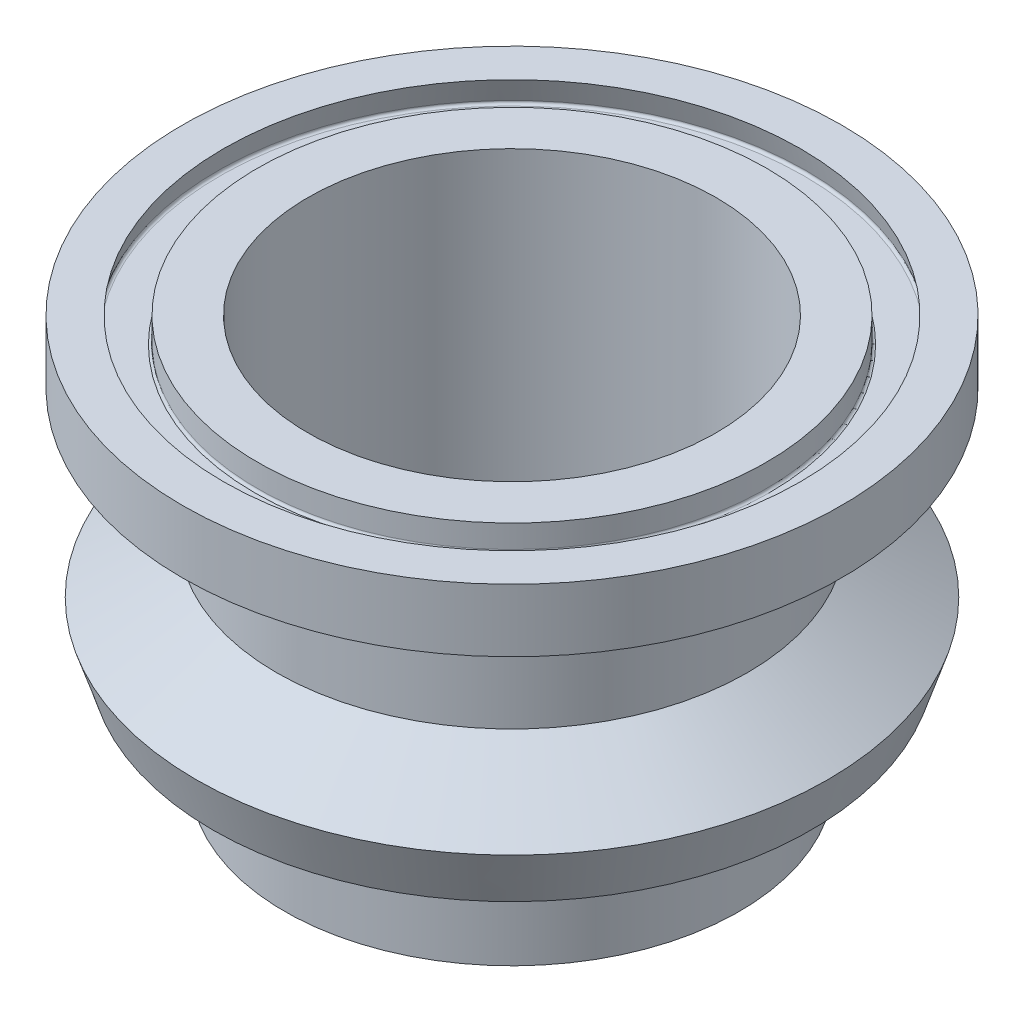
SolidWorks part; units mm, degrees
ref_plane "Front" through (0, 0, 0) normal (0, 0, 1) x (1, 0, 0)
ref_plane "Top" through (0, 0, 0) normal (0, 1, 0) x (1, 0, 0)
ref_plane "Right" through (0, 0, 0) normal (1, 0, 0) x (0, 0, -1)
sketch "Sketch1" plane through (0, 0, 0) normal (0, 0, 1) x (1, 0, 0)
  line L0 (0, 0) -> (0, 127) construction
  line L1 (33.3375, 127) -> (0, 127) construction
  line L2 (33.3375, 127) -> (33.3375, 120.65)
  line L3 (33.3375, 120.65) -> (23.8125, 120.65)
  line L4 (23.8125, 120.65) -> (23.8125, 107.5831)
  line L5 (23.8125, 107.5831) -> (31.9591, 102.2926)
  line L6 (33.3375, 101.3975) -> (31.75, 96.5116) construction
  line L7 (25.586, 98.3614) -> (22.9997, 98.9625)
  line L8 (22.9997, 98.9625) -> (22.9997, 86.2625)
  line L9 (22.9997, 86.2625) -> (20.6375, 86.2625)
  line L10 (29.9048, 99.8601) -> (26.4953, 100.7737)
  line L11 (20.6375, 86.2625) -> (20.6375, 127)
  line L12 (33.3375, 127) -> (29.183, 127)
  line L13 (25.7556, 127) -> (20.6375, 127)
  line L14 (0, 0) -> (26.9683, 100.6469) construction
  line L15 (28.885, 97.4542) -> (30.0591, 99.4877)
  line L16 (26.1842, 100.594) -> (25.586, 98.3614)
  line L17 (30.242, 97.0077) -> (28.885, 97.4542)
  line L18 (0, 101.6) -> (2.8607, 112.2763) construction
  line L19 (29.183, 127) -> (29.7847, 124.7543)
  line L20 (25.7556, 127) -> (25.7556, 124.6886)
  line L21 (29.5394, 124.4346) -> (26.0096, 124.4346)
  line L22 (0, 0) -> (68.5329, 165.453) construction
  line L23 (31.9591, 102.2926) -> (30.242, 97.0077)
  line L24 (31.8277, 101.888) -> (30.2402, 97.0022) construction
  arc A0 (26.4953, 100.7737) -> (26.1842, 100.594) centre (26.4296, 100.5283) ccw
  arc A1 (29.9048, 99.8601) -> (30.0591, 99.4877) centre (29.8391, 99.6147) cw
  circle A2 centre (0, 0) radius 101.6 construction
  circle A3 centre (27.4972, 98.6776) radius 1.7653 construction
  arc A4 (25.7556, 124.6886) -> (26.0096, 124.4346) centre (26.0096, 124.6886) ccw
  arc A5 (29.7847, 124.7543) -> (29.5394, 124.4346) centre (29.5394, 124.6886) cw
  point P26 (30.2246, 99.7744)
  point P31 (25.7556, 124.4346)
  point P34 (29.8704, 124.4346)
  dimension "D4" = 203.2
  dimension "D5" = 0.254
  dimension "D8" = 3.5306
  dimension "D28" = 0.254
  dimension "D1" = 15
  dimension "D3" = 45.9994
  dimension "D6" = 4.1148
  dimension "D7" = 2.5654
  dimension "D9" = 18
  dimension "D10" = 51.1048
  dimension "D11" = 27.4972
  dimension "D12" = 75
  dimension "D13" = 66.675
  dimension "D14" = 3.175
  dimension "D15" = 6.35
  dimension "D16" = 75
  dimension "D17" = 75
  dimension "D18" = 127
  dimension "D19" = 4.1148
  dimension "D20" = 13.0669
  dimension "D21" = 41.275
  dimension "D22" = 12.7
  dimension "D23" = 31.75
  dimension "D24" = 22.5
  dimension "D25" = 66.675
  dimension "D26" = 2.5654
  dimension "D27" = 51.5112
  dimension "D30" = 5.2905
  dimension "D31" = 5.5568
  dimension "D29" = 1.5875
revolve "Revolve1" add sketch "Sketch1" angle 360 about L0
